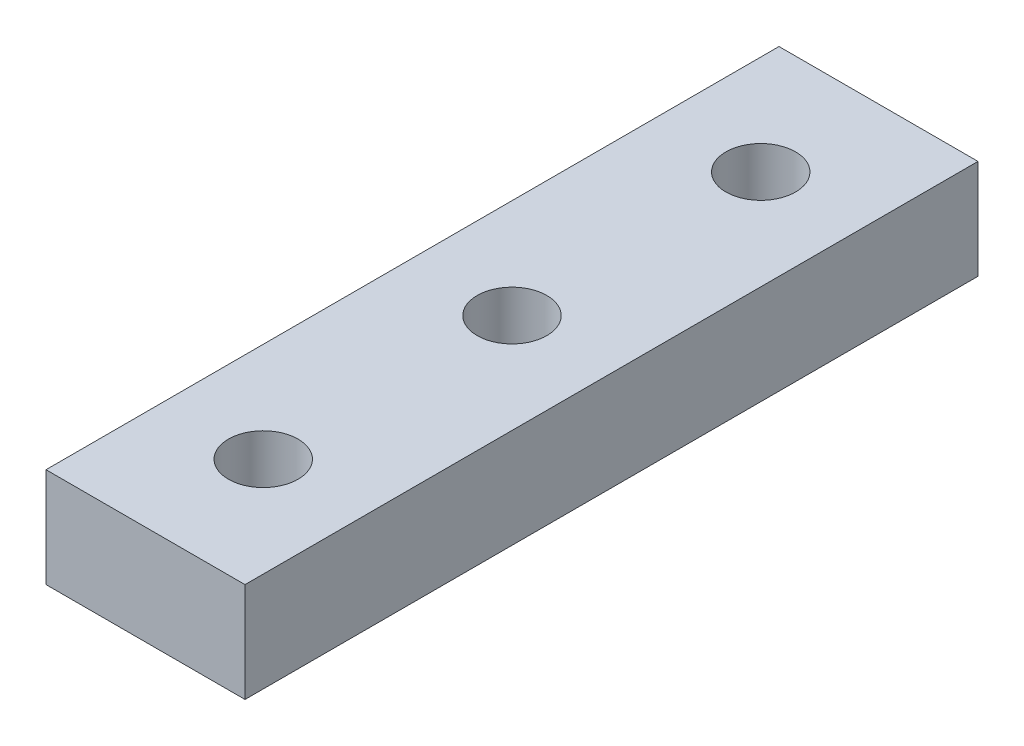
SolidWorks part; units mm, degrees
ref_plane "Спереди" through (0, 0, 0) normal (0, 0, 1) x (1, 0, 0)
ref_plane "Сверху" through (0, 0, 0) normal (0, 1, 0) x (1, 0, 0)
ref_plane "Справа" through (0, 0, 0) normal (1, 0, 0) x (0, 0, -1)
sketch "Эскиз1" plane through (0, 0, 0) normal (0, 1, 0) x (1, 0, 0)
  line L1 (0, 0) -> (12, 0)
  line L2 (0, 0) -> (0, 44.2)
  line L3 (0, 44.2) -> (12, 44.2)
  line L4 (12, 0) -> (12, 44.2)
  circle A0 centre (6, 22.1) radius 2.1
  circle A1 centre (6, 37.1) radius 2.1
  circle A2 centre (6, 7.1) radius 2.1
  point P11 (6, 0)
  point P12 (0, 22.1)
  point P13 (6, 39.2)
  point P14 (6, 5)
  dimension "D1" = 4.2
  dimension "D2" = 15
  dimension "D3" = 15
  dimension "D4" = 5
  dimension "D5" = 12
extrude "Бобышка-Вытянуть1" add sketch "Эскиз1" along normal blind 6
